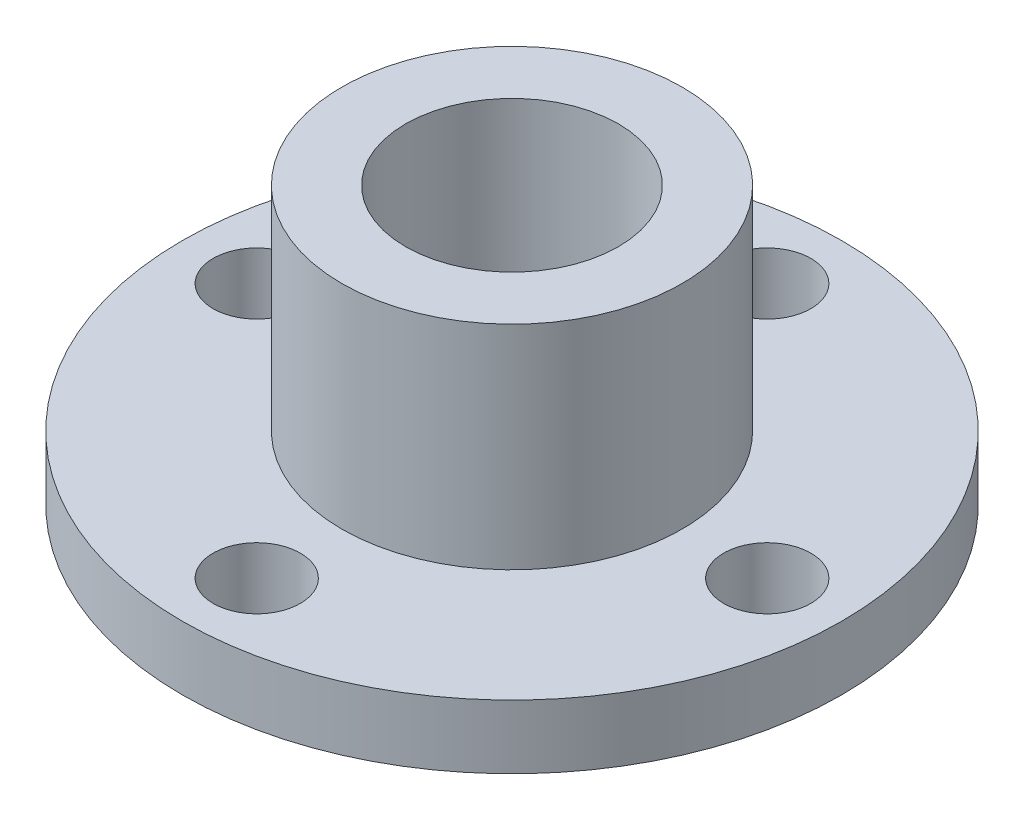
SolidWorks part; units mm, degrees
ref_plane "Front Plane" through (0, 0, 0) normal (0, 0, 1) x (1, 0, 0)
ref_plane "Top Plane" through (0, 0, 0) normal (0, 1, 0) x (1, 0, 0)
ref_plane "Right Plane" through (0, 0, 0) normal (1, 0, 0) x (0, 0, -1)
sketch "Sketch1" plane through (0, 0, 0) normal (0, 1, 0) x (1, 0, 0)
  line L0 (0, 28.9087) -> (0, -24.6607) construction
  line L1 (28.6353, 0) -> (-31.4762, 0) construction
  circle A0 centre (0, 0) radius 15.5
  circle A1 centre (0, 0) radius 5
  circle A2 centre (0, 12) radius 2.05
  circle A3 centre (12, 0) radius 2.05
  circle A4 centre (0, -12) radius 2.05
  circle A5 centre (-12, 0) radius 2.05
  dimension "D1" = 31
  dimension "D2" = 10
  dimension "D3" = 4.1
  dimension "D4" = 12
  dimension "D5" = 12
  dimension "D6" = 12
  dimension "D7" = 12
extrude "Boss-Extrude1" add sketch "Sketch1" along normal blind 3
sketch "Sketch2" plane through (0, 3, 0) normal (0, 1, 0) x (1, 0, 0)
  circle A0 centre (0, 0) radius 5.0032
  circle A1 centre (0, 0) radius 8
  dimension "D1" = 16
extrude "Boss-Extrude2" add sketch "Sketch2" along normal blind 10
